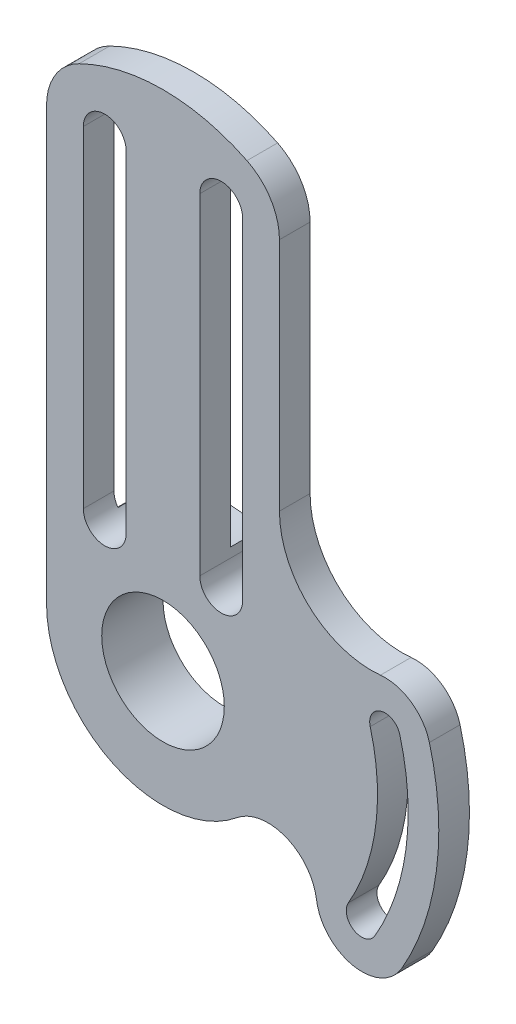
SolidWorks part; units mm, degrees
ref_plane "Plan de face" through (0, 0, 0) normal (0, 0, 1) x (1, 0, 0)
ref_plane "Plan de dessus" through (0, 0, 0) normal (0, 1, 0) x (1, 0, 0)
ref_plane "Plan de droite" through (0, 0, 0) normal (1, 0, 0) x (0, 0, -1)
sketch "Esquisse1" plane through (0, 0, 0) normal (0, 0, 1) x (1, 0, 0)
  line L0 (-38, -64.1914) -> (34.4444, -44.78) construction
  line L1 (-38, -64.1914) -> (26.9519, -101.6914) construction
  line L2 (0, 0) -> (0, 76.7176)
  line L3 (-38, -64.1914) -> (69.9489, -64.1914) construction
  line L4 (-76, -64.1914) -> (-76, 76.7176)
  line L5 (-57, 76.7176) -> (-57, -31.2824) construction
  line L6 (-50, 76.7176) -> (-50, -31.2824)
  line L7 (-64, 76.7176) -> (-64, -31.2824)
  line L8 (-19, 76.7176) -> (-19, -31.2824) construction
  line L9 (-12, 76.7176) -> (-12, -31.2824)
  line L10 (-26, 76.7176) -> (-26, -31.2824)
  arc A0 (-76, 76.7176) -> (-65.3953, 93.7621) centre (-57, 76.7176) cw
  arc A1 (-65.3953, 93.7621) -> (-10.6047, 93.7621) centre (-38, 38.1429) cw
  arc A2 (-10.6047, 93.7621) -> (0, 76.7176) centre (-19, 76.7176) cw
  arc A3 (-76, -64.1914) -> (-13.9017, -93.5729) centre (-38, -64.1914) ccw
  arc A4 (-13.9017, -93.5729) -> (12.0937, -103.7491) centre (-3.755, -105.944) cw
  arc A5 (12.0937, -103.7491) -> (39.9423, -109.1914) centre (26.9519, -101.6914) ccw
  arc A6 (39.9423, -109.1914) -> (48.9333, -40.8977) centre (-38, -64.1914) ccw
  arc A7 (48.9333, -40.8977) -> (32.963, -29.8533) centre (34.4444, -44.78) ccw
  arc A8 (0, 0) -> (32.963, -29.8533) centre (30, 0) ccw
  arc A10 (-50, 76.7176) -> (-64, 76.7176) centre (-57, 76.7176) ccw
  arc A11 (-64, -31.2824) -> (-50, -31.2824) centre (-57, -31.2824) ccw
  arc A12 (-12, 76.7176) -> (-26, 76.7176) centre (-19, 76.7176) ccw
  arc A13 (-26, -31.2824) -> (-12, -31.2824) centre (-19, -31.2824) ccw
  arc A14 (34.4444, -44.78) -> (26.8005, -101.9524) centre (-38, -64.1914) cw construction
  arc A15 (31.1206, -104.4698) -> (39.2741, -43.4859) centre (-38, -64.1914) ccw
  arc A16 (22.4805, -99.435) -> (29.6148, -46.0741) centre (-38, -64.1914) ccw
  arc A17 (22.4805, -99.435) -> (31.1206, -104.4698) centre (26.8005, -101.9524) ccw
  arc A18 (39.2741, -43.4859) -> (29.6148, -46.0741) centre (34.4444, -44.78) ccw
  circle A19 centre (-38, -64.1914) radius 20
  point P23 (-57, 22.7176)
  point P28 (-19, 22.7176)
  point P35 (36.3385, -74.1304)
  dimension "D2" = 62
  dimension "D3" = 19
  dimension "D4" = 19
  dimension "D6" = 38
  dimension "D7" = 16
  dimension "D8" = 15
  dimension "D9" = 90
  dimension "D10" = 15
  dimension "D11" = 30
  dimension "D15" = 7
  dimension "D16" = 7
  dimension "D17" = 5
  dimension "D18" = 40
  dimension "D1" = 76
  dimension "D5" = 0
  dimension "D12" = 15
  dimension "D13" = 30
  dimension "D14" = 108
extrude "Boss.-Extru.1" add sketch "Esquisse1" along normal blind 10
sketch "Esquisse3" plane through (0, 0, 0) normal (0, 0, -1) x (-1, 0, 0)
  circle A0 centre (38, -64.1914) radius 38
  circle A1 centre (38, -64.1914) radius 20
extrude "Boss.-Extru.2" add sketch "Esquisse3" along normal blind 10
sketch "Esquisse4" plane through (0, 0, 0) normal (0, 0, 1) x (1, 0, 0)
  line L0 (-26, -28.1359) -> (-26, -31.2824)
  line L1 (-50, -28.1359) -> (-50, -31.2824)
  arc A0 (-26, -31.2824) -> (-13.286, -35.3259) centre (-19, -31.2824) ccw
  arc A1 (-13.286, -35.3259) -> (-26, -28.1359) centre (-38, -64.1914) ccw
  arc A2 (-50, -31.2824) -> (-62.714, -35.3259) centre (-57, -31.2824) cw
  arc A3 (-50, -28.1359) -> (-62.714, -35.3259) centre (-38, -64.1914) ccw
extrude "Enlèv. mat.-Extru.1" cut sketch "Esquisse4" against normal through all
